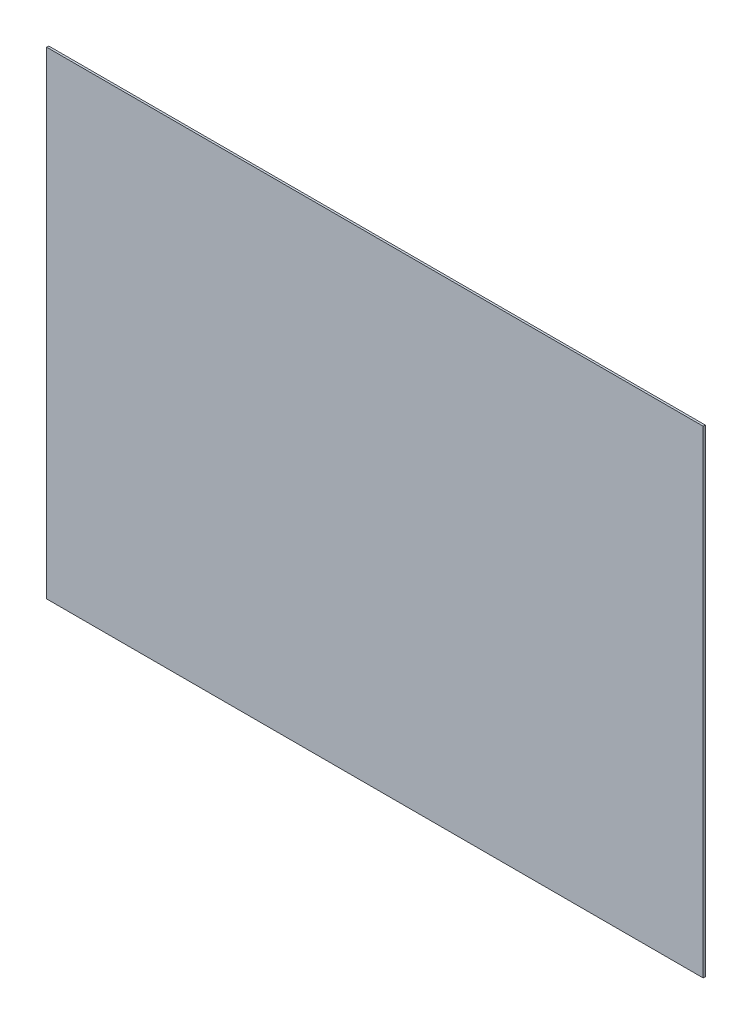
SolidWorks part; units mm, degrees
ref_plane "Plan de face" through (0, 0, 0) normal (0, 0, 1) x (1, 0, 0)
ref_plane "Plan de dessus" through (0, 0, 0) normal (0, 1, 0) x (1, 0, 0)
ref_plane "Plan de droite" through (0, 0, 0) normal (1, 0, 0) x (0, 0, -1)
sketch "Model" plane through (0, 0, 0) normal (0, 0, 1) x (1, 0, 0)
  line L0 (1032.3846, 654.3047) -> (822.3846, 654.3047)
  line L1 (822.3846, 654.3047) -> (822.3846, 464.3047)
  line L2 (822.3846, 464.3047) -> (1032.3846, 464.3047)
  line L3 (1032.3846, 464.3047) -> (1032.3846, 654.3047)
  line L4 (1302.0636, 362.1494) -> (1143.0636, 362.1494)
  line L5 (1143.0636, 362.1494) -> (1143.0636, 247.1494)
  line L6 (1143.0636, 247.1494) -> (1302.0636, 247.1494)
  line L7 (1302.0636, 247.1494) -> (1302.0636, 362.1494)
  line L8 (1290.7747, 654.3047) -> (1131.7747, 654.3047)
  line L9 (1131.7747, 654.3047) -> (1131.7747, 464.3047)
  line L10 (1131.7747, 464.3047) -> (1290.7747, 464.3047)
  line L11 (1290.7747, 464.3047) -> (1290.7747, 654.3047)
  line L12 (1023.1433, 413.8035) -> (813.1433, 413.8035)
  line L13 (813.1433, 413.8035) -> (813.1433, 211.8035)
  line L14 (813.1433, 211.8035) -> (1023.1433, 211.8035)
  line L15 (1023.1433, 211.8035) -> (1023.1433, 413.8035)
extrude "Boss.-Extru.1" add sketch "Model" along normal blind 0.5 contours L7 L4 L5 L6
sketch "Esquisse1" plane through (0, 0, 0.5) normal (0, 0, 1) x (1, 0, 0)
  line L0 (1143.0636, 362.1494) -> (1143.0636, 247.1494) construction
  line L1 (1136.3267, 365.3669) -> (1144.0636, 365.3669)
  line L2 (1136.3267, 365.3669) -> (1136.3267, 244.7728)
  line L3 (1136.3267, 244.7728) -> (1144.0636, 244.7728)
  line L4 (1144.0636, 365.3669) -> (1144.0636, 244.7728)
  dimension "D1" = 1
extrude "Enlèv. mat.-Extru.1" cut sketch "Esquisse1" against normal through all
